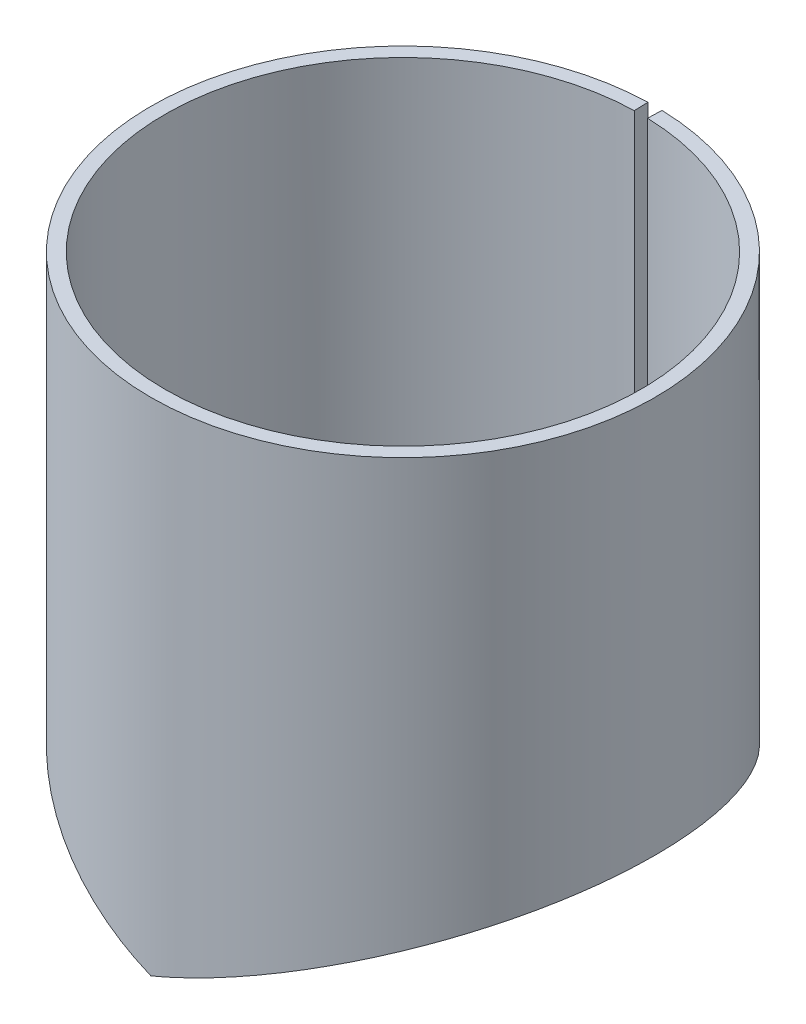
SolidWorks part; units mm, degrees
ref_plane "前视基准面" through (0, 0, 0) normal (0, 0, 1) x (1, 0, 0)
ref_plane "上视基准面" through (0, 0, 0) normal (0, 1, 0) x (1, 0, 0)
ref_plane "右视基准面" through (0, 0, 0) normal (1, 0, 0) x (0, 0, -1)
imported_body "基体零件-带补料的垂直三通管-1"
sheet metal parameters "钣金1" parameters "D1"=0.7366, "厚度"=1
bend "圆角折弯1" bend radius 16.963 bend angle 356.81 parameters "D5"=1
flatten bends "展开-折弯1"
sketch "尖角-草图1" plane through (0.5, 32.2566, -17.9561) normal (0.0278, 0, -0.9996) x (-0.9996, 0, -0.0278)
  line L0 (-52.8187, -17.7434) -> (-52.8187, 17.7434) construction
  dimension "D1" = 0
process bends "加工-折弯1" parameters "D1"=0
sketch "平面-草图1" plane through (0.5, 32.2566, -17.9561) normal (0.0278, 0, -0.9996) x (-0.9996, 0, -0.0278)
